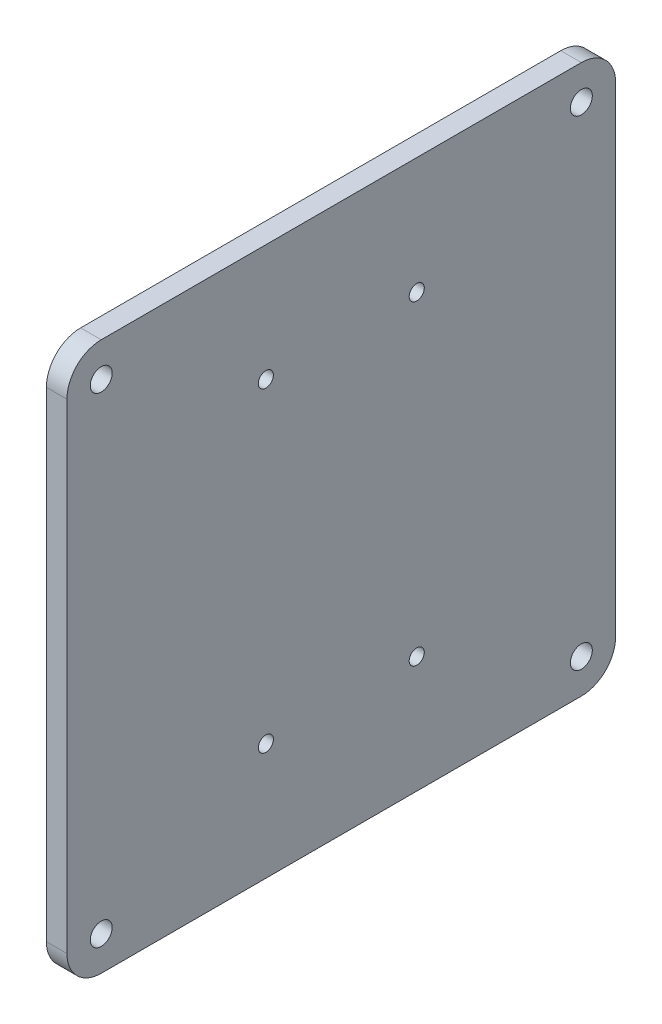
SolidWorks part; units mm, degrees
ref_plane "Plan de face" through (0, 0, 0) normal (0, 0, 1) x (1, 0, 0)
ref_plane "Plan de dessus" through (0, 0, 0) normal (0, 1, 0) x (1, 0, 0)
ref_plane "Plan de droite" through (0, 0, 0) normal (1, 0, 0) x (0, 0, -1)
sketch "Esquisse1" plane through (0, 0, 0) normal (1, 0, 0) x (0, 0, -1)
  line L0 (0, -62.5338) -> (0, 31.6695) construction
  line L1 (35, 40) -> (-35, 40)
  line L2 (40, 35) -> (40, -35)
  line L3 (35, -40) -> (-35, -40)
  line L4 (-40, 35) -> (-40, -35)
  line L5 (35, -35) -> (-35, -35) construction
  line L6 (35, -35) -> (35, 35) construction
  line L7 (35, 35) -> (-35, 35) construction
  line L8 (-35, -35) -> (-35, 35) construction
  line L9 (35, -35) -> (-35, 35) construction
  line L10 (35, 35) -> (-35, -35) construction
  line L11 (11, 23) -> (-11, 23) construction
  line L12 (11, 23) -> (11, -23) construction
  line L13 (11, -23) -> (-11, -23) construction
  line L14 (-11, 23) -> (-11, -23) construction
  line L15 (11, 23) -> (-11, -23) construction
  line L16 (11, -23) -> (-11, 23) construction
  line L17 (65.7544, 0) -> (-23.6179, 0) construction
  circle A0 centre (-35, 35) radius 1.6
  circle A1 centre (-11, 23) radius 1.1
  circle A2 centre (35, 35) radius 1.6
  circle A3 centre (11, 23) radius 1.1
  circle A4 centre (35, -35) radius 1.6
  circle A5 centre (11, -23) radius 1.1
  circle A6 centre (-11, -23) radius 1.1
  circle A7 centre (-35, -35) radius 1.6
  arc A8 (-35, -40) -> (-40, -35) centre (-35, -35) cw
  arc A9 (40, -35) -> (35, -40) centre (35, -35) cw
  arc A10 (35, 40) -> (40, 35) centre (35, 35) cw
  arc A11 (-35, 40) -> (-40, 35) centre (-35, 35) ccw
  point P0 (0, 0)
  point P10 (0, 0)
  dimension "D1" = 5
extrude "Boss.-Extru.1" add sketch "Esquisse1" along normal blind 3
